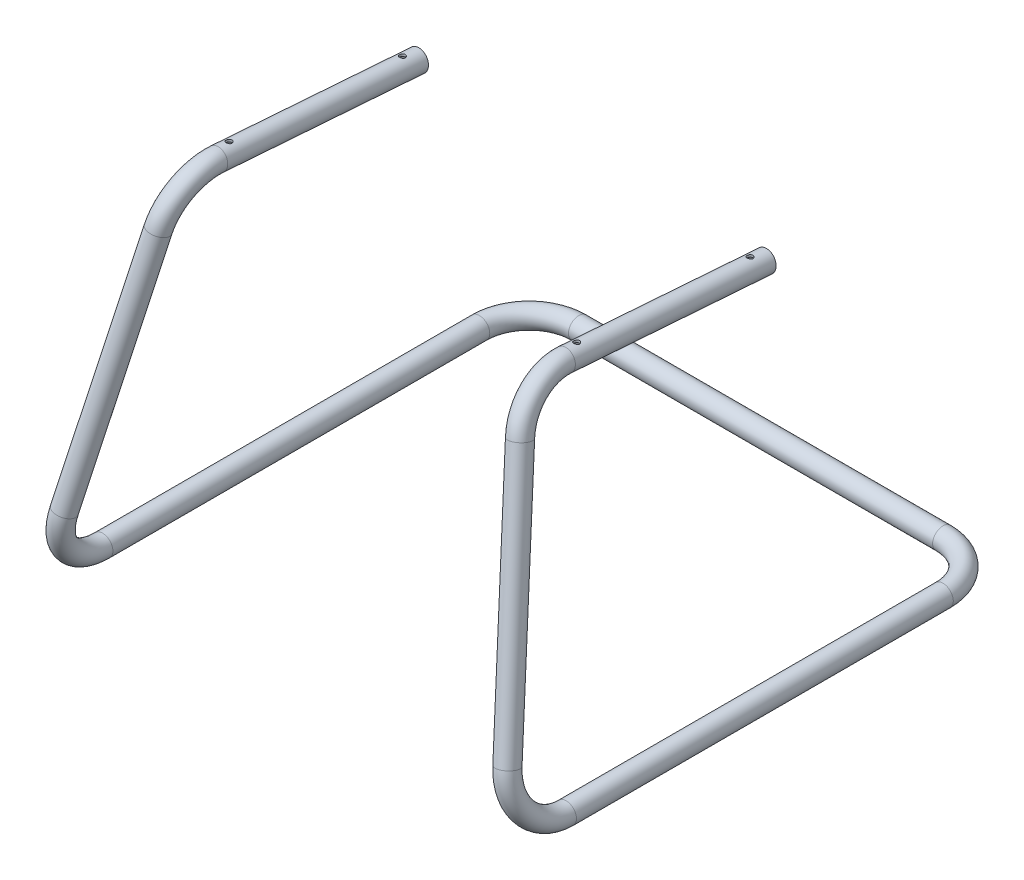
SolidWorks part; units mm, degrees
ref_plane "Plan de face" through (0, 0, 0) normal (0, 0, 1) x (1, 0, 0)
ref_plane "Plan de dessus" through (0, 0, 0) normal (0, 1, 0) x (1, 0, 0)
ref_plane "Plan de droite" through (0, 0, 0) normal (1, 0, 0) x (0, 0, -1)
ref_plane "Plan Inférieur" through (0, -430, 0) normal (0, 1, 0) x (1, 0, 0)
ref_plane "Plan1" through (-210, 0, 0) normal (1, 0, 0) x (0, 0, -1)
sketch "Esquisse1" plane through (-210, 0, 0) normal (1, 0, 0) x (0, 0, -1)
  line L0 (-248.2883, -21.5919) -> (45.9194, -43.1971)
  line L1 (44, 0) -> (-44, 0) construction
  line L2 (16, -41) -> (16.9155, -28.5336) construction
  line L3 (-183.4629, -26.3524) -> (-182.5474, -13.8859) construction
  point P0 (16, -41)
  dimension "D1" = 41
  dimension "D2" = 16
  dimension "D3" = 4.2
  dimension "D4" = 30
  dimension "D6" = 12.5
  dimension "D7" = 200
  dimension "D8" = 65
sketch "Esquisse2" plane through (0, 0, 0) normal (0, 0, 1) x (1, 0, 0)
  line L0 (-210, -21.5919) -> (-280, -430)
  line L1 (0, -55) -> (0, 55) construction
  line L2 (44, -430) -> (-44, -430) construction
  dimension "D3" = 280
sketch "Esquisse3" plane through (0, 0, 0) normal (1, 0, 0) x (0, 0, -1)
  line L0 (-248.2883, -21.5919) -> (-340, -430)
  line L1 (0, 55) -> (0, -55) construction
  line L2 (44, -430) -> (-44, -430) construction
  dimension "D2" = 340
curve "Courbe1"
sketch3d "Esquisse3D3"
  line L0 (0, -430, -250) -> (-220, -430, -250)
  line L1 (-280, -430, -190) -> (-280, -430, 265.2681)
  line L2 (-210, -21.5919, 248.2883) -> (-280, -430, 340) construction
  line L3 (-218.5515, -71.485, 259.4923) -> (-267.6736, -358.0826, 323.8503)
  line L4 (-210, -21.5919, 248.2883) -> (-210, -43.1971, -45.9194) construction
  line L5 (-210, -25.389, 196.5818) -> (-210, -43.1971, -45.9194)
  arc A0 (-218.5515, -71.485, 259.4923) -> (-210, -25.389, 196.5818) centre (-220.0023, -84.3905, 200.9146) ccw
  arc A1 (-280, -430, 265.2681) -> (-267.6736, -358.0826, 323.8503) centre (-269.864, -370.8624, 265.2681) ccw
  arc A2 (-220, -430, -250) -> (-280, -430, -190) centre (-220, -430, -190) ccw
  point P14 (-280, -430, 340)
  point P16 (-329.0016, -360.7263, 265.2681)
  point P19 (-280, -430, -250)
  point P20 (-220, -370, -190)
  point P27 (-210, -21.5919, 248.2883)
  point P29 (-279.1627, -74.4151, 200.1821)
  dimension "D2" = 60
  dimension "D1" = 250
sketch "Esquisse8" plane through (0, 0, 0) normal (1, 0, 0) x (0, 0, -1)
  circle A0 centre (250, -430) radius 12.5
  circle A1 centre (250, -430) radius 10
  dimension "D1" = 25
  dimension "D2" = 2.5
sweep "Balayage1" add profiles "Esquisse8" path "Esquisse3D3"
sketch "Esquisse9" plane through (-210, 0, 0) normal (1, 0, 0) x (0, 0, -1)
  line L1 (25.021, -54.6975) -> (27.1762, -25.3497) construction
  line L2 (-197.5339, -38.3541) -> (44.9673, -56.1622)
  line L3 (-197.5339, -38.3541) -> (44.9673, -56.1622) construction
  line L4 (26.9252, -28.7673) -> (25.021, -54.6975)
  line L5 (25.021, -54.6975) -> (17.021, -54.11)
  line L6 (17.021, -54.11) -> (21.8616, -49.9317)
  line L7 (21.8616, -49.9317) -> (23.4346, -28.511)
  line L8 (26.9252, -28.7673) -> (23.4346, -28.511)
  line L9 (46.8349, -30.7307) -> (-195.6663, -12.9225) construction
  dimension "D2" = 20
  dimension "D3" = 3.5
  dimension "D4" = 45
  dimension "D5" = 8
  dimension "D6" = 0.5
  dimension "D1" = 0.5
revolve "Enlèvement de matière-Révolution1" cut sketch "Esquisse9" angle 360 about L4
pattern_linear "Répétition linéaire1" count 2 spacing 210 along (0, 0.0732, 0.9973) of "Enlèvement de matière-Révolution1"
mirror "Symétrie1" about plane through (0, 0, 0) normal (1, 0, 0)
